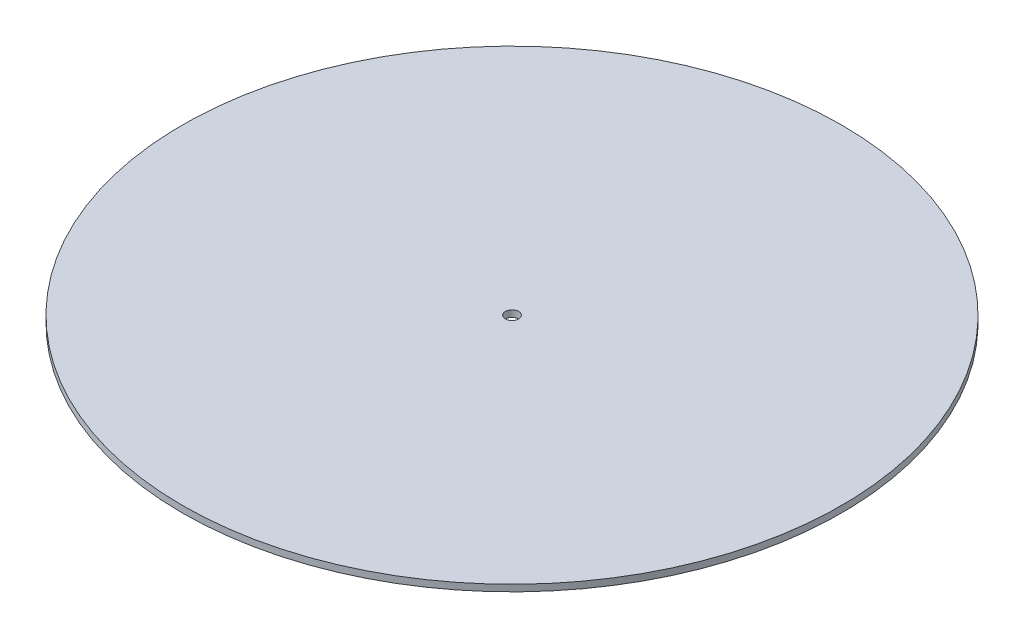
SolidWorks part; units mm, degrees
ref_plane "Front" through (0, 0, 0) normal (0, 0, 1) x (1, 0, 0)
ref_plane "Top" through (0, 0, 0) normal (0, 1, 0) x (1, 0, 0)
ref_plane "Right" through (0, 0, 0) normal (1, 0, 0) x (0, 0, -1)
sketch "Sketch1" plane through (0, 0, 0) normal (0, 1, 0) x (1, 0, 0)
  circle A0 centre (0, 0) radius 50
  circle A1 centre (0, 0) radius 1
extrude "Extrude1" add sketch "Sketch1" along normal blind 1
